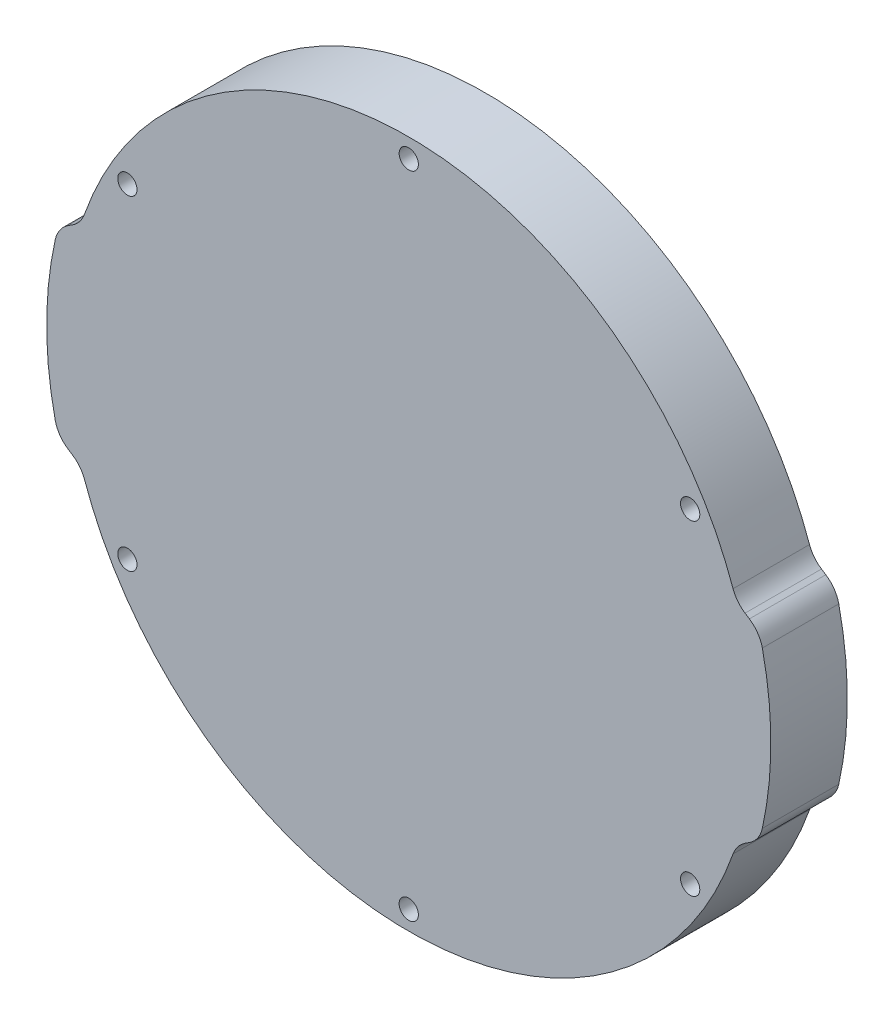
SolidWorks part; units mm, degrees
ref_plane "Front Plane" through (0, 0, 0) normal (0, 0, 1) x (1, 0, 0)
ref_plane "Top Plane" through (0, 0, 0) normal (0, 1, 0) x (1, 0, 0)
ref_plane "Right Plane" through (0, 0, 0) normal (1, 0, 0) x (0, 0, -1)
sketch "Sketch1" plane through (0, 0, 0) normal (0, 0, 1) x (1, 0, 0)
  line L0 (-58.2497, 15) -> (-54.4047, 17.5)
  line L1 (-58.2497, -15) -> (-54.4047, -17.5)
  line L2 (58.2497, 15) -> (54.4047, 17.5)
  line L3 (58.2497, -15) -> (54.4047, -17.5)
  line L4 (0, 0) -> (46.7437, 26.9875) construction
  line L5 (46.7437, 26.9875) -> (49.4934, 28.575) construction
  line L6 (0, 53.975) -> (0, 0) construction
  arc A0 (-54.4047, -17.5) -> (54.4047, -17.5) centre (0, 0) ccw
  circle A1 centre (0, 53.975) radius 1.6
  circle A2 centre (46.7437, 26.9875) radius 1.6
  circle A3 centre (46.7437, -26.9875) radius 1.6
  circle A4 centre (0, -53.975) radius 1.6
  circle A5 centre (-46.7437, -26.9875) radius 1.6
  circle A6 centre (-46.7437, 26.9875) radius 1.6
  arc A7 (-58.2497, 15) -> (-58.2497, -15) centre (0, 0) ccw
  arc A8 (58.2497, 15) -> (58.2497, -15) centre (0, 0) cw
  arc A9 (54.4047, 17.5) -> (-54.4047, 17.5) centre (0, 0) ccw
  point P17 (0, 0)
  point P19 (-60.15, 0)
  point P24 (60.15, 0)
  dimension "D1" = 114.3
  dimension "D2" = 3.175
  dimension "D3" = 3.2
  dimension "D8" = 3
  dimension "D5" = 35
  dimension "D7" = 30
  dimension "D9" = 3.175
  dimension "D10" = 60
  dimension "D4" = 6
extrude "Boss-Extrude1" add sketch "Sketch1" along normal blind 12.7
fillet "Fillet1" radius 5 8 edges at (54.4047, 17.5, 6.35) (58.2497, 15, 6.35) (58.2497, -15, 6.35) (54.4047, -17.5, 6.35) (-54.4047, -17.5, 6.35) (-58.2497, -15, 6.35) (-54.4047, 17.5, 6.35) (-58.2497, 15, 6.35)
